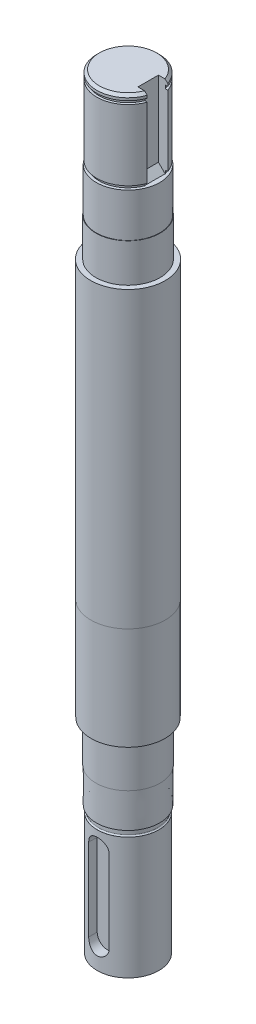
SolidWorks part; units mm, degrees
ref_plane "前视基准面" through (0, 0, 0) normal (0, 0, 1) x (1, 0, 0)
ref_plane "上视基准面" through (0, 0, 0) normal (0, 1, 0) x (1, 0, 0)
ref_plane "右视基准面" through (0, 0, 0) normal (1, 0, 0) x (0, 0, -1)
sketch "草图1" plane through (0, 0, 0) normal (0, 0, 1) x (1, 0, 0)
  line L0 (0, 326.057) -> (0, 371.1505) construction
  line L1 (0, 0) -> (12, 0)
  line L2 (12, 0) -> (12, 50)
  line L3 (12, 50) -> (12.35, 50)
  line L4 (12.5, 79.5) -> (12.5, 63.5)
  line L5 (12.5, 79.5) -> (14.4, 79.5)
  line L6 (14.5, 119.5) -> (14.5, 234)
  line L7 (14.5, 234) -> (12.5, 234)
  line L8 (12.5, 234) -> (12.5, 249)
  line L9 (14.5, 119.5) -> (14.4, 119.5)
  line L10 (14.4, 119.5) -> (14.4, 79.5)
  line L11 (12.35, 50) -> (12.3427, 63.5)
  line L12 (12.5, 63.5) -> (12.3427, 63.5)
  line L13 (12.5, 249) -> (12.35, 249)
  line L14 (12.35, 249) -> (12.35, 266)
  line L15 (12.35, 266) -> (11.2573, 266)
  line L16 (11.2573, 266) -> (11.2573, 267.3)
  line L17 (11.2573, 267.3) -> (12.15, 267.3)
  line L18 (12.15, 294.7) -> (12.15, 267.3)
  line L19 (11.25, 296) -> (11.25, 294.7)
  line L20 (11.25, 294.7) -> (12.15, 294.7)
  line L21 (12.15, 296) -> (12.15, 298)
  line L22 (12.15, 298) -> (0, 298)
  line L23 (12.15, 296) -> (11.25, 296)
  line L24 (0, 0) -> (0, 326.057) construction
  line L25 (0, 0) -> (0, 298)
  dimension "D15" = 1.3
  dimension "D1" = 12
  dimension "D2" = 30
  dimension "D3" = 32
  dimension "D4" = 12.35
  dimension "D5" = 298
  dimension "D6" = 16
  dimension "D7" = 12.5
  dimension "D8" = 1.3
  dimension "D9" = 12.5
  dimension "D10" = 12.35
  dimension "D11" = 15
  dimension "D12" = 40
  dimension "D13" = 154.5
  dimension "D14" = 12.15
revolve "旋转2" add sketch "草图1" angle 360 about L0
chamfer "倒角2" distance 1 angle 45 1 edges at (0, 298, -12.15)
sketch "草图5" plane through (0, 0, 0) normal (0, 0, 1) x (1, 0, 0)
  line L0 (0, 0) -> (0, 50) construction
  line L1 (-12, 50) -> (12, 50) construction
  line L2 (12, 50) -> (12, 47.5)
  line L3 (12, 0) -> (12, 50) construction
  line L4 (12, 47.5) -> (11.99, 47.5)
  line L5 (11.5, 47.99) -> (11.5, 49.51)
  line L6 (11.99, 50) -> (12, 50)
  arc A0 (11.99, 47.5) -> (11.5, 47.99) centre (11.99, 47.99) cw
  arc A1 (11.5, 49.51) -> (11.99, 50) centre (11.99, 49.51) cw
  point P16 (11.5, 50)
  dimension "D1" = 0.49
revolve "切除-旋转1" cut sketch "草图5" angle 360 about L0
ref_plane "基准面1" through (0, 0, 12) normal (0, 0, 1) x (1, 0, 0)
sketch "草图6" plane through (0, 0, 12) normal (0, 0, 1) x (1, 0, 0)
  line L0 (0, 0) -> (0, 5) construction
  line L1 (0, 5) -> (0, 25) construction
  line L2 (0, 9) -> (0, 41) construction
  line L4 (-4, 9) -> (-4, 41)
  line L5 (4, 9) -> (4, 41)
  arc A0 (-4, 9) -> (4, 9) centre (0, 9) ccw
  arc A1 (4, 41) -> (-4, 41) centre (0, 41) ccw
  point P6 (0, 45)
  point P7 (0, 5)
  point P8 (0, 25)
  dimension "D1" = 8
  dimension "D2" = 40
  dimension "D3" = 5
extrude "切除-拉伸1" cut sketch "草图6" against normal blind 4
ref_plane "基准面3" through (12.15, 0, 0) normal (1, 0, 0) x (0, 0, -1)
sketch "草图8" plane through (12.15, 0, 0) normal (1, 0, 0) x (0, 0, -1)
  line L0 (0, 266) -> (0, 298) construction
  line L1 (12.35, 266) -> (-12.35, 266) construction
  line L2 (11.15, 298) -> (-11.15, 298) construction
  line L3 (-4, 266) -> (4, 266)
  line L4 (-4, 266) -> (-4, 298)
  line L5 (-4, 298) -> (4, 298)
  line L6 (4, 266) -> (4, 298)
extrude "切除-拉伸3" cut sketch "草图8" against normal blind 4.3
chamfer "倒角3" distance 2.6 1 edges at (7.85, 266, 0)
